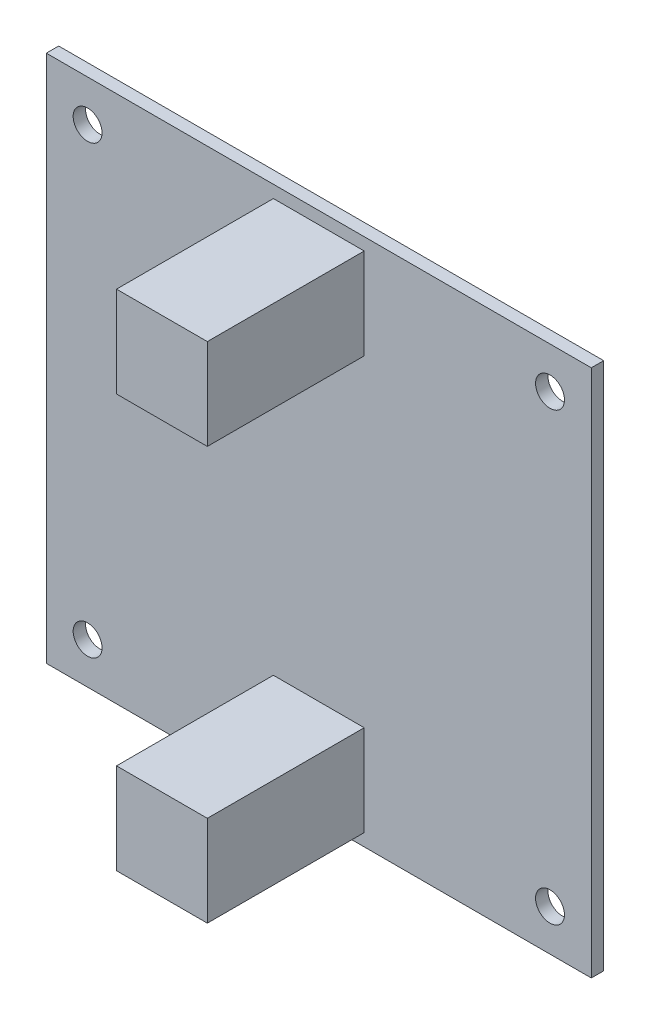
SolidWorks part; units mm, degrees
ref_plane "Front Plane" through (0, 0, 0) normal (0, 0, 1) x (1, 0, 0)
ref_plane "Top Plane" through (0, 0, 0) normal (0, 1, 0) x (1, 0, 0)
ref_plane "Right Plane" through (0, 0, 0) normal (1, 0, 0) x (0, 0, -1)
sketch "Sketch1" plane through (0, 0, 0) normal (0, 0, 1) x (1, 0, 0)
  line L1 (-33, 32) -> (33, 32)
  line L2 (-33, 32) -> (-33, -32)
  line L3 (-33, -32) -> (33, -32)
  line L4 (33, 32) -> (33, -32)
  line L5 (-33, 32) -> (33, -32) construction
  line L6 (-33, -32) -> (33, 32) construction
  point P0 (0, 0)
  dimension "D1" = 64
  dimension "D2" = 66
extrude "Boss-Extrude1" add sketch "Sketch1" along normal blind 1.5
sketch "Sketch2" plane through (0, 0, 1.5) normal (0, 0, 1) x (1, 0, 0)
  line L0 (33, 32) -> (-33, 32) construction
  line L1 (-33, 32) -> (-33, -32) construction
  line L2 (0, -0.825) -> (0, 0.825) construction
  line L3 (0.825, 0) -> (-0.825, 0) construction
  circle A0 centre (-28, 27) radius 1.75
  circle A1 centre (28, 27) radius 1.75
  circle A2 centre (28, -27) radius 1.75
  circle A3 centre (-28, -27) radius 1.75
  dimension "D1" = 3.5
  dimension "D2" = 5
  dimension "D3" = 5
extrude "Cut-Extrude1" cut sketch "Sketch2" against normal up to next
sketch "Sketch4" plane through (0, 0, 1.5) normal (0, 0, 1) x (1, 0, 0)
  line L0 (0, -0.825) -> (0, 0.825) construction
  line L1 (-5.5, 30.5) -> (5.5, 30.5)
  line L2 (-5.5, 30.5) -> (-5.5, 19.5)
  line L3 (-5.5, 19.5) -> (5.5, 19.5)
  line L4 (5.5, 30.5) -> (5.5, 19.5)
  line L5 (-5.5, 30.5) -> (5.5, 19.5) construction
  line L6 (-5.5, 19.5) -> (5.5, 30.5) construction
  line L7 (33, 32) -> (-33, 32) construction
  point P0 (0, 25)
  dimension "D1" = 11
  dimension "D2" = 11
  dimension "D3" = 1.5
extrude "Boss-Extrude2" add sketch "Sketch4" along normal blind 19
mirror "Mirror1" about plane through (0, 0, 0) normal (0, 1, 0) of "Boss-Extrude2"
